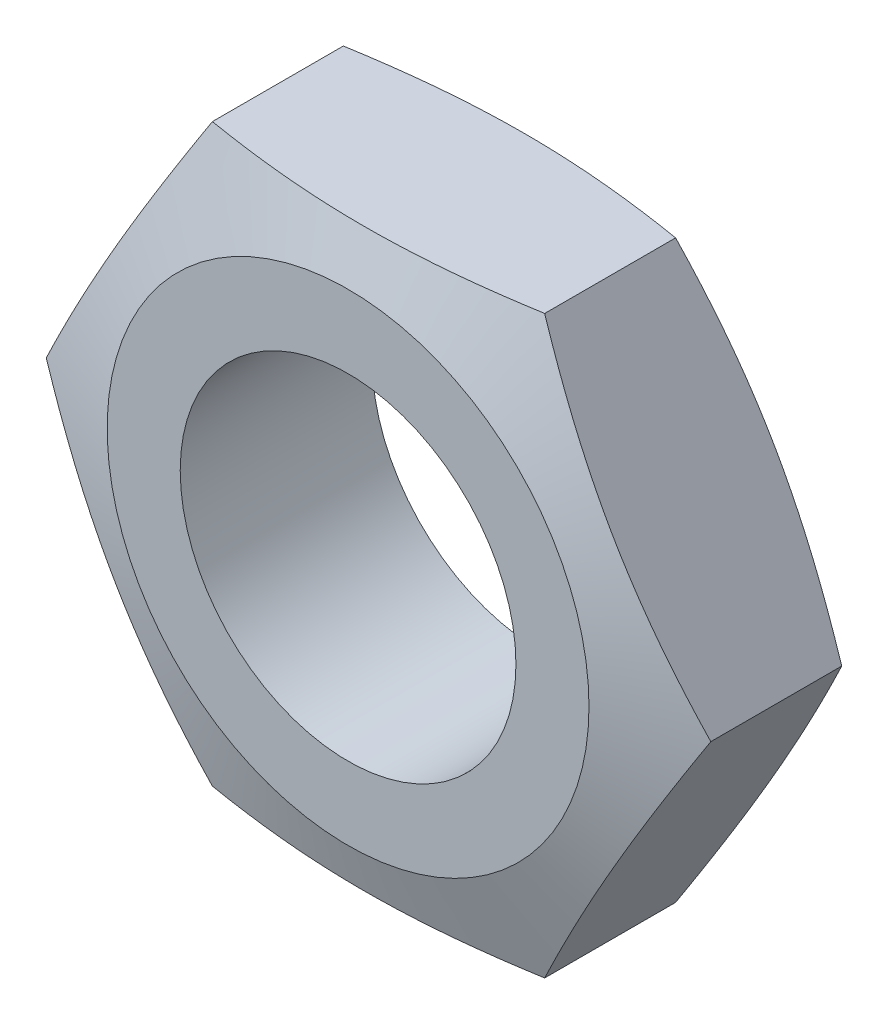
SolidWorks part; units mm, degrees
ref_plane "Front" through (0, 0, 0) normal (0, 0, 1) x (1, 0, 0)
ref_plane "Top" through (0, 0, 0) normal (0, 1, 0) x (1, 0, 0)
ref_plane "Right" through (0, 0, 0) normal (1, 0, 0) x (0, 0, -1)
sketch "Sketch1" plane through (0, 0, 0) normal (0, 0, 1) x (1, 0, 0)
  line L1 (-13.8564, 0) -> (-6.9282, -12)
  line L2 (-6.9282, -12) -> (6.9282, -12)
  line L3 (6.9282, -12) -> (13.8564, 0)
  line L4 (13.8564, 0) -> (6.9282, 12)
  line L5 (6.9282, 12) -> (-6.9282, 12)
  line L6 (-6.9282, 12) -> (-13.8564, 0)
  circle A0 centre (0, 0) radius 12 construction
  circle A1 centre (0, 0) radius 7
  dimension "D2" = 14
  dimension "D1" = 24
extrude "Boss-Extrude1" add sketch "Sketch1" along normal mid plane 8
sketch "Sketch2" plane through (0, 0, 0) normal (0, 1, 0) x (1, 0, 0)
  line L0 (10.0464, 4) -> (13.8564, 2.73)
  line L1 (13.8564, 4) -> (6.9282, 4) construction
  line L2 (13.8564, -4) -> (13.8564, 4) construction
  line L3 (13.8564, 2.73) -> (13.8564, 4)
  line L4 (13.8564, 4) -> (10.0464, 4)
  line L5 (0, 0) -> (0, 6.0182) construction
  line L6 (10.0464, -4) -> (13.8564, -2.73)
  line L7 (13.8564, -4) -> (6.9282, -4) construction
  line L8 (13.8564, -2.73) -> (13.8564, -4)
  line L9 (13.8564, -4) -> (10.0464, -4)
  dimension "D1" = 1.27
  dimension "D2" = 3.81
  dimension "D3" = 1.27
revolve "Cut-Revolve1" cut sketch "Sketch2" angle 360 about L5
